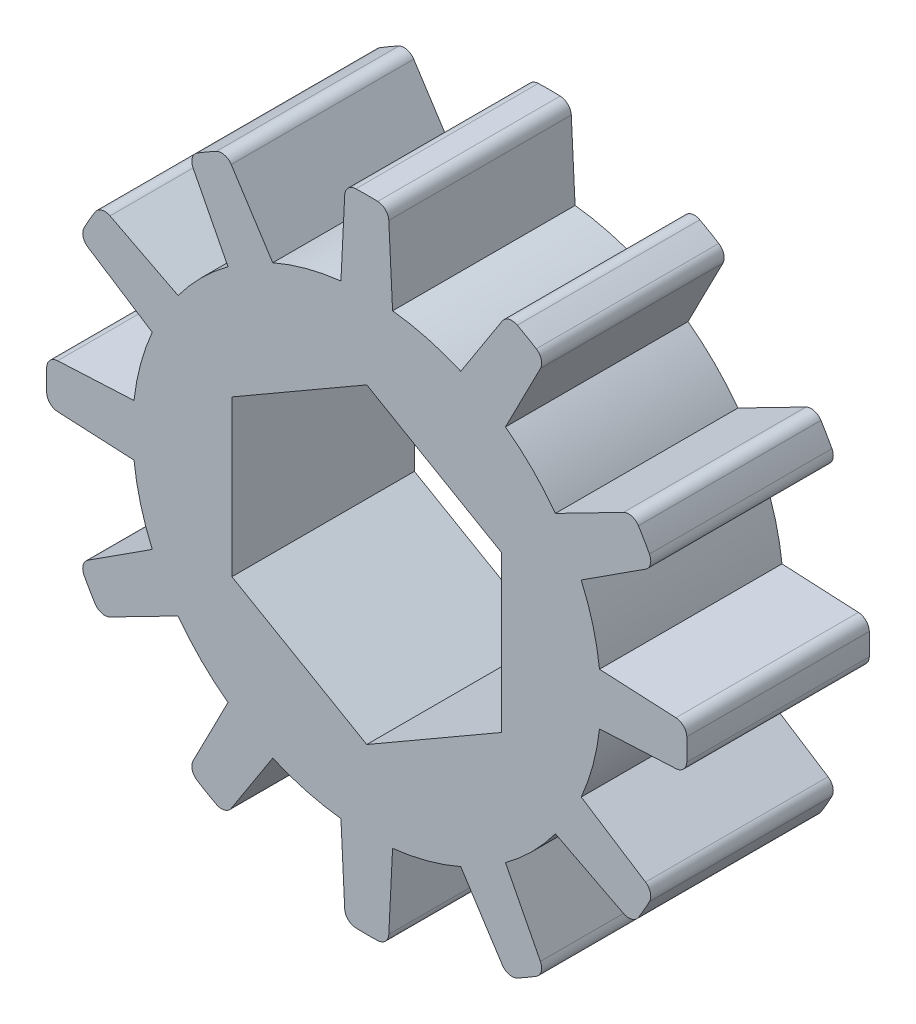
SolidWorks part; units mm, degrees
ref_plane "Alzado" through (0, 0, 0) normal (0, 0, 1) x (1, 0, 0)
ref_plane "Planta" through (0, 0, 0) normal (0, 1, 0) x (1, 0, 0)
ref_plane "Vista lateral" through (0, 0, 0) normal (1, 0, 0) x (0, 0, -1)
sketch "Croquis1" plane through (0, 0, 0) normal (0, 0, 1) x (1, 0, 0)
  line L0 (0, 0) -> (0, 4.6049) construction
  line L1 (0.375, 5.5679) -> (0.45, 4.0556)
  line L2 (-0.375, 5.5679) -> (-0.45, 4.0556)
  line L3 (2.4592, 5.0094) -> (1.6381, 3.7373)
  line L4 (3.1087, 4.6344) -> (2.4175, 3.2873)
  line L5 (4.6344, 3.1087) -> (3.2873, 2.4175)
  line L6 (5.0094, 2.4592) -> (3.7373, 1.6381)
  line L7 (5.5679, 0.375) -> (4.0556, 0.45)
  line L8 (5.5679, -0.375) -> (4.0556, -0.45)
  line L9 (5.0094, -2.4592) -> (3.7373, -1.6381)
  line L10 (4.6344, -3.1087) -> (3.2873, -2.4175)
  line L11 (3.1087, -4.6344) -> (2.4175, -3.2873)
  line L12 (2.4592, -5.0094) -> (1.6381, -3.7373)
  line L13 (0.375, -5.5679) -> (0.45, -4.0556)
  line L14 (-0.375, -5.5679) -> (-0.45, -4.0556)
  line L15 (-2.4592, -5.0094) -> (-1.6381, -3.7373)
  line L16 (-3.1087, -4.6344) -> (-2.4175, -3.2873)
  line L17 (-4.6344, -3.1087) -> (-3.2873, -2.4175)
  line L18 (-5.0094, -2.4592) -> (-3.7373, -1.6381)
  line L19 (-5.5679, -0.375) -> (-4.0556, -0.45)
  line L20 (-5.5679, 0.375) -> (-4.0556, 0.45)
  line L21 (-5.0094, 2.4592) -> (-3.7373, 1.6381)
  line L22 (-4.6344, 3.1087) -> (-3.2873, 2.4175)
  line L23 (-3.1087, 4.6344) -> (-2.4175, 3.2873)
  line L24 (-2.4592, 5.0094) -> (-1.6381, 3.7373)
  circle A0 centre (0, 0) radius 0.5
  arc A1 (1.6381, 3.7373) -> (0.45, 4.0556) centre (0, 0) ccw
  arc A2 (3.1087, 4.6344) -> (2.4592, 5.0094) centre (0, 0) ccw
  arc A3 (5.0094, 2.4592) -> (4.6344, 3.1087) centre (0, 0) ccw
  arc A4 (5.5679, -0.375) -> (5.5679, 0.375) centre (0, 0) ccw
  arc A5 (4.6344, -3.1087) -> (5.0094, -2.4592) centre (0, 0) ccw
  arc A6 (2.4592, -5.0094) -> (3.1087, -4.6344) centre (0, 0) ccw
  arc A7 (-0.375, -5.5679) -> (0.375, -5.5679) centre (0, 0) ccw
  arc A8 (-3.1087, -4.6344) -> (-2.4592, -5.0094) centre (0, 0) ccw
  arc A9 (-5.0094, -2.4592) -> (-4.6344, -3.1087) centre (0, 0) ccw
  arc A10 (-5.5679, 0.375) -> (-5.5679, -0.375) centre (0, 0) ccw
  arc A11 (-4.6344, 3.1087) -> (-5.0094, 2.4592) centre (0, 0) ccw
  arc A12 (-2.4592, 5.0094) -> (-3.1087, 4.6344) centre (0, 0) ccw
  arc A13 (0.375, 5.5679) -> (-0.375, 5.5679) centre (0, 0) ccw
  arc A14 (3.2873, 2.4175) -> (2.4175, 3.2873) centre (0, 0) ccw
  arc A15 (4.0556, 0.45) -> (3.7373, 1.6381) centre (0, 0) ccw
  arc A16 (3.7373, -1.6381) -> (4.0556, -0.45) centre (0, 0) ccw
  arc A17 (2.4175, -3.2873) -> (3.2873, -2.4175) centre (0, 0) ccw
  arc A18 (0.45, -4.0556) -> (1.6381, -3.7373) centre (0, 0) ccw
  arc A19 (-1.6381, -3.7373) -> (-0.45, -4.0556) centre (0, 0) ccw
  arc A20 (-3.2873, -2.4175) -> (-2.4175, -3.2873) centre (0, 0) ccw
  arc A21 (-4.0556, -0.45) -> (-3.7373, -1.6381) centre (0, 0) ccw
  arc A22 (-3.7373, 1.6381) -> (-4.0556, 0.45) centre (0, 0) ccw
  arc A23 (-2.4175, 3.2873) -> (-3.2873, 2.4175) centre (0, 0) ccw
  arc A24 (-0.45, 4.0556) -> (-1.6381, 3.7373) centre (0, 0) ccw
  dimension "D1" = 0.9
  dimension "D2" = 1
  dimension "D4" = 1.5
  dimension "D3" = 0.75
  dimension "D6" = 1.23
  dimension "D5" = 12
extrude "Saliente-Extruir1" add sketch "Croquis1" along normal blind 3.18
sketch "Croquis10" plane through (0, 0, 0) normal (0, 0, -1) x (-1, 0, 0)
  line L1 (0, -2.7135) -> (2.35, -1.3568)
  line L2 (2.35, -1.3568) -> (2.35, 1.3568)
  line L3 (2.35, 1.3568) -> (0, 2.7135)
  line L4 (0, 2.7135) -> (-2.35, 1.3568)
  line L5 (-2.35, 1.3568) -> (-2.35, -1.3568)
  line L6 (-2.35, -1.3568) -> (0, -2.7135)
  circle A0 centre (0, 0) radius 2.35 construction
  dimension "D1" = 4.7
extrude "Cortar-Extruir3" cut sketch "Croquis10" against normal through all
fillet "Redondeo1" radius 0.2 24 edges at (5.5679, -0.375, 1.59) (-2.4592, -5.0094, 1.59) (-3.1087, -4.6344, 1.59) (0.375, -5.5679, 1.59) (-0.375, -5.5679, 1.59) (3.1087, -4.6344, 1.59) (2.4592, -5.0094, 1.59) (5.0094, -2.4592, 1.59) (4.6344, -3.1087, 1.59) (-4.6344, -3.1087, 1.59) (-5.0094, -2.4592, 1.59) (-5.5679, -0.375, 1.59) (-5.5679, 0.375, 1.59) (-5.0094, 2.4592, 1.59) (-4.6344, 3.1087, 1.59) (-3.1087, 4.6344, 1.59) (-2.4592, 5.0094, 1.59) (5.5679, 0.375, 1.59) (5.0094, 2.4592, 1.59) (4.6344, 3.1087, 1.59) (3.1087, 4.6344, 1.59) (2.4592, 5.0094, 1.59) (0.375, 5.5679, 1.59) (-0.375, 5.5679, 1.59)
